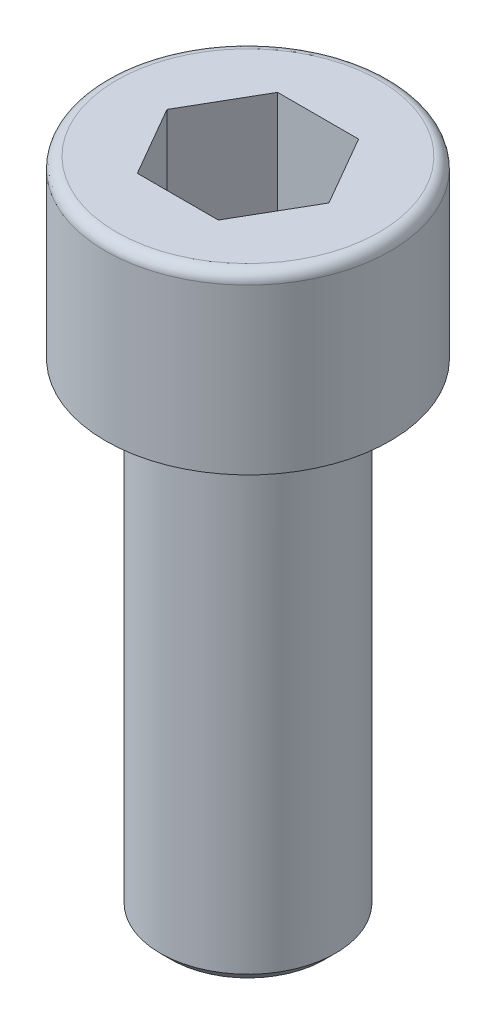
SolidWorks part; units mm, degrees
ref_plane "Front" through (0, 0, 0) normal (0, 0, 1) x (1, 0, 0)
ref_plane "Top" through (0, 0, 0) normal (0, 1, 0) x (1, 0, 0)
ref_plane "Right" through (0, 0, 0) normal (1, 0, 0) x (0, 0, -1)
sketch "Sketch1" plane through (0, 0, 0) normal (0, 1, 0) x (1, 0, 0)
  circle A0 centre (0, 0) radius 6.5
  dimension "D1" = 13
extrude "Boss-Extrude1" add sketch "Sketch1" along normal mid plane 8
sketch "Sketch2" plane through (0, -4, 0) normal (0, -1, 0) x (1, 0, 0)
  circle A0 centre (0, 0) radius 4
  dimension "D1" = 8
extrude "Boss-Extrude2" add sketch "Sketch2" along normal blind 22
sketch "Sketch3" plane through (0, -26, 0) normal (0, -1, 0) x (1, 0, 0)
  circle A0 centre (0, 0) radius 3.5
  dimension "D1" = 7
extrude "Cut-Extrude1" cut sketch "Sketch3" against normal blind 25 draft 45 flip side to cut
sketch "Sketch4" plane through (0, 4, 0) normal (0, 1, 0) x (1, 0, 0)
  line L1 (1.8475, 3.2) -> (-1.8475, 3.2)
  line L2 (-1.8475, 3.2) -> (-3.695, 0)
  line L3 (-3.695, 0) -> (-1.8475, -3.2)
  line L4 (-1.8475, -3.2) -> (1.8475, -3.2)
  line L5 (1.8475, -3.2) -> (3.695, 0)
  line L6 (3.695, 0) -> (1.8475, 3.2)
  circle A0 centre (0, 0) radius 3.2 construction
  dimension "D1" = 6.4
extrude "Cut-Extrude2" cut sketch "Sketch4" against normal blind 5
fillet "Fillet1" radius 0.5 1 edges at (0, 4, 6.5)
